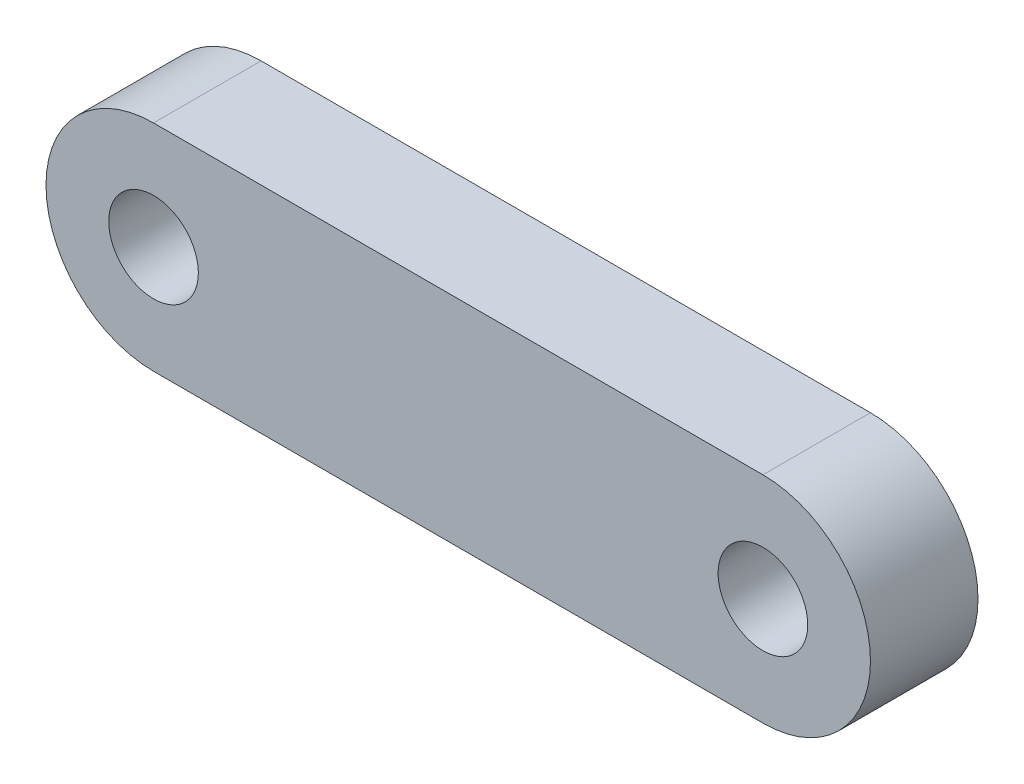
SolidWorks part; units mm, degrees
ref_plane "Front Plane" through (0, 0, 0) normal (0, 0, 1) x (1, 0, 0)
ref_plane "Top Plane" through (0, 0, 0) normal (0, 1, 0) x (1, 0, 0)
ref_plane "Right Plane" through (0, 0, 0) normal (1, 0, 0) x (0, 0, -1)
sketch "Sketch1" plane through (0, 0, 0) normal (0, 0, 1) x (1, 0, 0)
  line L0 (0, 0) -> (-17, 0) construction
  line L1 (0, -3) -> (-17, -3)
  line L2 (0, 3) -> (-17, 3)
  arc A0 (0, -3) -> (0, 3) centre (0, 0) ccw
  arc A1 (-17, 3) -> (-17, -3) centre (-17, 0) ccw
  circle A2 centre (0, 0) radius 1.25
  circle A3 centre (-17, 0) radius 1.25
  point P3 (-8.5, 0)
  dimension "D1" = 3
  dimension "D3" = 2.5
  dimension "D4" = 2.5
  dimension "D2" = 17
extrude "Boss-Extrude1" add sketch "Sketch1" along normal blind 3
